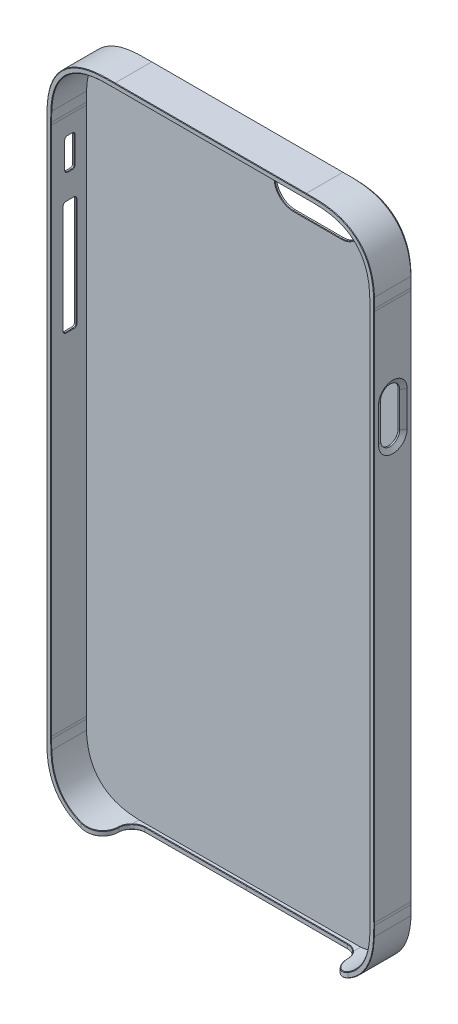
SolidWorks part; units mm, degrees
ref_plane "Alzado" through (0, 0, 0) normal (0, 0, 1) x (1, 0, 0)
ref_plane "Planta" through (0, 0, 0) normal (0, 1, 0) x (1, 0, 0)
ref_plane "Vista lateral" through (0, 0, 0) normal (1, 0, 0) x (0, 0, -1)
sketch "Croquis1" plane through (0, 0, 0) normal (0, 0, 1) x (1, 0, 0)
  line L5 (-140.1494, -3.7576) -> (-142.1279, -3.7576)
  line L16 (-140.1474, 51.4816) -> (-140.1474, 80.9616)
  line L17 (-140.1474, -4.2216) -> (-140.1474, 51.4816)
  line L18 (-140.1474, 51.4816) -> (-140.1474, 80.9616)
  line L19 (-140.1474, -4.2216) -> (-140.1474, 51.4816)
  line L33 (-140.1474, 80.9616) -> (-140.1474, 91.1616)
  line L36 (-209.1174, 107.1847) -> (-209.1174, 103.0696)
  line L37 (-154.5145, 121.5516) -> (-194.7504, 121.5516)
  line L38 (-140.1474, 91.1616) -> (-140.1474, 107.1847)
  line L39 (-209.1174, 107.1847) -> (-209.1174, 103.0696)
  line L40 (-154.5145, 121.5516) -> (-194.7504, 121.5516)
  line L41 (-140.1474, 91.1616) -> (-140.1474, 107.1847)
  line L44 (-150.313, -18.4382) -> (-197.0805, -18.575)
  line L45 (-209.1174, 68.2096) -> (-209.1174, -4.2216)
  line L46 (-209.1174, 68.2096) -> (-209.1174, -4.2216)
  line L47 (-209.1174, 68.2096) -> (-209.1174, 103.0696)
  spline S19 degree 3 poles (-1096.1153, 286.7428) (-158.9407, -76.2316) (-140.157, -30.5078) (-140.1396, -5.1272) (-140.14, -5.0005) (-140.1415, -4.7484) (-140.1426, -4.6248) (-142.7619, 329.0701) (-145.3803, 662.6411) (-147.9989, 996.2116) knots -24.327282 -24.327282 -24.327282 -24.327282 0.5 0.5 0.625 0.625 0.75 0.75 337.321247 337.321247 337.321247 337.321247 only from (-140.1709, -6.8015) to (-140.1494, -3.7576)
  spline S20 degree 3 poles (10596.5565, -21471.9083) (-373.0822, 618.2006) (-222.5435, -37.2569) (-147.5726, -17.8855) (-146.8942, -17.6499) (-145.5876, -17.0402) (-144.9599, -16.6687) (-144.0862, -16.0108) (-143.8063, -15.7747) (-143.2746, -15.2688) (-143.024, -14.9994) (-142.3243, -14.1556) (-141.9247, -13.5435) (-141.2585, -12.2602) (-140.9933, -11.5876) (-118.6996, 63.7143) (-829.1948, 236.0168) (21434.9054, -10505.7862) knots -13.481883 -13.481883 -13.481883 -13.481883 0.125 0.125 0.25 0.25 0.375 0.375 0.4375 0.4375 0.5 0.5 0.625 0.625 0.75 0.75 14.480461 14.480461 14.480461 14.480461 only from (-150.313, -18.4382) to (-140.1709, -6.8015)
  spline S22 degree 3 poles (-150.313, -18.4382) (-149.6264, -18.3576) (-148.9375, -18.2382) (-147.5726, -17.8855) (-146.8942, -17.6499) (-145.5876, -17.0402) (-144.9599, -16.6687) (-144.0862, -16.0108) (-143.8063, -15.7747) (-143.2746, -15.2688) (-143.024, -14.9994) (-142.3243, -14.1556) (-141.9247, -13.5435) (-141.2585, -12.2602) (-140.9933, -11.5876) (-140.3899, -9.5496) (-140.2305, -8.1585) (-140.1709, -6.8015) knots 0 0 0 0 0.125 0.125 0.25 0.25 0.375 0.375 0.4375 0.4375 0.5 0.5 0.625 0.625 0.75 0.75 1 1 1 1
  spline S35 degree 3 poles (-21608.4449, 10693.918) (21117.6762, -11397.0508) (-21185.0362, 11790.8934) (20689.3897, -11913.1281) knots -409.88411 -409.88411 -409.88411 -409.88411 410.03234 410.03234 410.03234 410.03234 only from (-140.1416, -4.7497) to (-140.1474, -4.2216)
  spline S36 degree 3 poles (-22072.2785, 9707.2404) (21604.4405, -10409.9708) (-21694.4237, 10806.1344) (21221.0865, -10932.7045) knots -106.808987 -106.808987 -106.808987 -106.808987 108.936675 108.936675 108.936675 108.936675 only from (-140.1709, -6.8015) to (-140.1416, -4.7497)
  spline S37 degree 3 poles (-140.1416, -4.7497) (-140.143, -4.5724) (-140.145, -4.3963) (-140.1474, -4.2216) knots 0 0 0 0 1 1 1 1
  spline S38 degree 3 poles (-140.1709, -6.8015) (-140.1403, -6.1063) (-140.1363, -5.4195) (-140.1416, -4.7497) knots 0 0 0 0 1 1 1 1
  spline S73 degree 3 poles (21259.18, -10590.9548) (-21466.941, 11500.0139) (20835.7713, -11687.9302) (-21038.6545, 12016.0912) knots -409.88411 -409.88411 -409.88411 -409.88411 410.03234 410.03234 410.03234 410.03234 only from (-209.1233, 107.7129) to (-209.1174, 107.1847)
  spline S74 degree 3 poles (21723.0137, -9604.2772) (-21953.7053, 10512.9339) (21345.1588, -10703.1713) (-21570.3513, 11035.6676) knots -106.808987 -106.808987 -106.808987 -106.808987 108.936675 108.936675 108.936675 108.936675 only from (-209.094, 109.7646) to (-209.1233, 107.7129)
  spline S75 degree 3 poles (-10801.3002, 21643.3549) (-28.9993, -429.2618) (-122.897, 134.4698) (-200.7147, 121.1241) (-201.5799, 120.9011) (-203.2628, 120.2345) (-204.0722, 119.7955) (-205.1812, 118.977) (-205.5332, 118.6774) (-206.191, 118.0247) (-206.4933, 117.675) (-207.3205, 116.572) (-207.766, 115.7654) (-208.4451, 114.0858) (-208.6735, 113.2207) (-222.1816, 36.5608) (338.8212, -58.2507) (-21959.2671, 10241.8024) knots -10.85602 -10.85602 -10.85602 -10.85602 0.25 0.25 0.375 0.375 0.5 0.5 0.5625 0.5625 0.625 0.625 0.75 0.75 0.875 0.875 11.81479 11.81479 11.81479 11.81479 only from (-194.7504, 121.5516) to (-209.094, 109.7646)
  spline S76 degree 3 poles (21609.3626, 10241.5069) (-688.0753, -58.2488) (-127.0834, 36.5616) (-140.5913, 113.2207) (-140.8197, 114.0858) (-141.4989, 115.7654) (-141.9443, 116.572) (-142.7715, 117.675) (-143.0738, 118.0247) (-143.7316, 118.6774) (-144.0837, 118.977) (-145.1926, 119.7955) (-146.0021, 120.2345) (-147.685, 120.9011) (-148.5501, 121.1241) (-226.3684, 134.4699) (-320.2669, -429.2698) (10452.2639, 21643.8233) knots -10.814685 -10.814685 -10.814685 -10.814685 0.125 0.125 0.25 0.25 0.375 0.375 0.4375 0.4375 0.5 0.5 0.625 0.625 0.75 0.75 11.856099 11.856099 11.856099 11.856099 only from (-140.1709, 109.7646) to (-154.5145, 121.5516)
  spline S77 degree 3 poles (21221.4874, 11035.8707) (-21694.7524, -10703.3333) (21604.6957, 10513.055) (-22072.4589, -9604.3603) knots -107.937347 -107.937347 -107.937347 -107.937347 107.809284 107.809284 107.809284 107.809284 only from (-140.1416, 107.7129) to (-140.1709, 109.7646)
  spline S78 degree 3 poles (20689.5764, 12016.1969) (-21185.6906, -11688.2984) (21118.8078, 11500.6323) (-21610.0631, -10591.7915) knots -409.033558 -409.033558 -409.033558 -409.033558 410.894461 410.894461 410.894461 410.894461 only from (-140.1474, 107.1847) to (-140.1416, 107.7129)
  spline S79 degree 3 poles (-209.1233, 107.7129) (-209.1219, 107.5356) (-209.1198, 107.3595) (-209.1174, 107.1847) knots 0 0 0 0 1 1 1 1
  spline S80 degree 3 poles (-209.094, 109.7646) (-209.1245, 109.0694) (-209.1285, 108.3827) (-209.1233, 107.7129) knots 0 0 0 0 1 1 1 1
  spline S81 degree 3 poles (-194.7504, 121.5516) (-196.3756, 121.5744) (-198.1164, 121.5697) (-200.7147, 121.1241) (-201.5799, 120.9011) (-203.2628, 120.2345) (-204.0722, 119.7955) (-205.1812, 118.977) (-205.5332, 118.6774) (-206.191, 118.0247) (-206.4933, 117.675) (-207.3205, 116.572) (-207.766, 115.7654) (-208.4451, 114.0858) (-208.6735, 113.2207) (-208.9788, 111.4886) (-209.0564, 110.6201) (-209.094, 109.7646) knots 0 0 0 0 0.25 0.25 0.375 0.375 0.5 0.5 0.5625 0.5625 0.625 0.625 0.75 0.75 0.875 0.875 1 1 1 1
  spline S82 degree 3 poles (-140.1709, 109.7646) (-140.2085, 110.6201) (-140.2861, 111.4886) (-140.5913, 113.2207) (-140.8197, 114.0858) (-141.4989, 115.7654) (-141.9443, 116.572) (-142.7715, 117.675) (-143.0738, 118.0247) (-143.7316, 118.6774) (-144.0837, 118.977) (-145.1926, 119.7955) (-146.0021, 120.2345) (-147.685, 120.9011) (-148.5501, 121.1241) (-151.1484, 121.5697) (-152.8892, 121.5744) (-154.5145, 121.5516) knots 0 0 0 0 0.125 0.125 0.25 0.25 0.375 0.375 0.4375 0.4375 0.5 0.5 0.625 0.625 0.75 0.75 1 1 1 1
  spline S83 degree 3 poles (-140.1416, 107.7129) (-140.1363, 108.3827) (-140.1403, 109.0694) (-140.1709, 109.7646) knots 0 0 0 0 1 1 1 1
  spline S84 degree 3 poles (-140.1474, 107.1847) (-140.145, 107.3595) (-140.143, 107.5356) (-140.1416, 107.7129) knots 0 0 0 0 1 1 1 1
  spline S88 degree 3 poles (-21682.2426, -10714.3251) (522.8439, 261.5338) (-233.5537, 62.6471) (-207.8126, -12.876) (-206.9668, -14.3155) (-205.2058, -16.0262) (-204.5482, -16.5125) (-203.1494, -17.3194) (-202.4063, -17.6394) (-127.053, -41.4547) (58.2883, 692.5988) (-10805.5064, -21539.7725) knots -12.056417 -12.056417 -12.056417 -12.056417 0.25 0.25 0.5 0.5 0.625 0.625 0.75 0.75 13.107269 13.107269 13.107269 13.107269 only from (-209.094, -6.8015) to (-197.0805, -18.575)
  spline S89 degree 3 poles (-21570.7522, -10932.9075) (21345.4875, 10806.2965) (-21953.9605, -10410.0918) (21723.194, 9707.3234) knots -107.937347 -107.937347 -107.937347 -107.937347 107.809284 107.809284 107.809284 107.809284 only from (-209.1233, -4.7497) to (-209.094, -6.8015)
  spline S90 degree 3 poles (-21038.8412, -11913.2338) (20836.4257, 11791.2615) (-21468.0726, -11397.6691) (21260.7982, 10694.7546) knots -409.033558 -409.033558 -409.033558 -409.033558 410.894461 410.894461 410.894461 410.894461 only from (-209.1174, -4.2216) to (-209.1233, -4.7497)
  spline S91 degree 3 poles (-209.094, -6.8015) (-209.0275, -8.3135) (-208.8376, -9.8687) (-207.8126, -12.876) (-206.9668, -14.3155) (-205.2058, -16.0262) (-204.5482, -16.5125) (-203.1494, -17.3194) (-202.4063, -17.6394) (-200.1425, -18.3549) (-198.5879, -18.5218) (-197.0805, -18.575) knots 0 0 0 0 0.25 0.25 0.5 0.5 0.625 0.625 0.75 0.75 1 1 1 1
  spline S92 degree 3 poles (-209.1233, -4.7497) (-209.1285, -5.4195) (-209.1245, -6.1063) (-209.094, -6.8015) knots 0 0 0 0 1 1 1 1
  spline S93 degree 3 poles (-209.1174, -4.2216) (-209.1198, -4.3963) (-209.1219, -4.5724) (-209.1233, -4.7497) knots 0 0 0 0 1 1 1 1
  dimension "D1" = 1
  dimension "D2" = 1
  dimension "D4" = 1
  dimension "D3" = 1
extrude "Saliente-Extruir1" add sketch "Croquis1" along normal blind 8.4
sketch "Croquis2" plane through (0, 0, 8.4) normal (0, 0, 1) x (1, 0, 0)
  line L16 (-208.1233, 107.7223) -> (-208.1174, 107.1902)
  line L17 (-208.1174, 107.1902) -> (-208.1174, -4.2271)
  line L18 (-208.1174, -4.2271) -> (-208.1233, -4.7592)
  line L19 (-197.0641, -17.575) -> (-150.3738, -17.4384)
  line L20 (-141.1415, -4.7592) -> (-141.1474, -4.2271)
  line L21 (-141.1474, -4.2271) -> (-141.1474, 107.1902)
  line L22 (-141.1474, 107.1902) -> (-141.1415, 107.7223)
  line L23 (-154.5074, 120.5516) -> (-194.7574, 120.5516)
  line L24 (-208.1233, 107.7223) -> (-208.1174, 107.1902)
  line L25 (-208.1174, 107.1902) -> (-208.1174, -4.2271)
  line L26 (-208.1174, -4.2271) -> (-208.1233, -4.7592)
  line L27 (-197.0641, -17.575) -> (-150.3738, -17.4384)
  line L28 (-141.1415, -4.7592) -> (-141.1474, -4.2271)
  line L29 (-141.1474, -4.2271) -> (-141.1474, 107.1902)
  line L30 (-141.1474, 107.1902) -> (-141.1415, 107.7223)
  line L31 (-154.5074, 120.5516) -> (-194.7574, 120.5516)
  spline S16 degree 3 poles (-3205.7699, -81.6252) (2792.241, 224.0248) (-3208.5375, -225.8688) (2789.8108, 59.0522) knots -58.686811 -58.686811 -58.686811 -58.686811 57.439594 57.439594 57.439594 57.439594 only from (-208.1233, -4.7592) to (-208.0949, -6.7576)
  spline S17 degree 3 poles (-3180.5876, -400.9387) (-17.3155, 101.053) (-220.1554, 26.5423) (-207.2636, -11.3879) (-207.1273, -11.7279) (-206.8207, -12.3868) (-206.65, -12.7069) (-206.2719, -13.3272) (-206.0637, -13.6283) (-205.6091, -14.2046) (-205.3662, -14.4753) (-204.848, -14.9806) (-204.5729, -15.2154) (-203.9929, -15.6517) (-203.6861, -15.8543) (-202.7366, -16.4051) (-202.0703, -16.695) (-201.0267, -17.0276) (-200.6711, -17.1217) (-199.9588, -17.2786) (-199.6006, -17.342) (-160.4017, -22.9081) (-102.0994, 113.587) (-489.4912, -3001.828) knots -6.520508 -6.520508 -6.520508 -6.520508 0.25 0.25 0.3125 0.3125 0.375 0.375 0.4375 0.4375 0.5 0.5 0.5625 0.5625 0.625 0.625 0.75 0.75 0.8125 0.8125 0.875 0.875 7.619701 7.619701 7.619701 7.619701 only from (-208.0949, -6.7576) to (-197.0641, -17.575)
  spline S18 degree 3 poles (566.2726, -2928.9047) (-296.2111, 206.6142) (-184.1381, -34.0737) (-146.3392, -16.2862) (-146.0476, -16.1309) (-145.4884, -15.7947) (-145.2189, -15.613) (-144.7011, -15.2209) (-144.4528, -15.0105) (-143.9797, -14.5582) (-143.7547, -14.3153) (-143.1312, -13.5595) (-142.7763, -13.0149) (-142.3249, -12.1434) (-142.1882, -11.8426) (-141.9467, -11.236) (-141.8409, -10.9287) (-141.5653, -9.9957) (-141.4348, -9.3595) (-136.0038, 28.9017) (-263.4162, 93.3591) (2512.374, -1405.3837) knots -7.675067 -7.675067 -7.675067 -7.675067 0.25 0.25 0.3125 0.3125 0.375 0.375 0.4375 0.4375 0.5 0.5 0.625 0.625 0.6875 0.6875 0.75 0.75 0.875 0.875 8.147229 8.147229 8.147229 8.147229 only from (-150.3738, -17.4384) to (-141.1699, -6.7576)
  spline S19 degree 3 poles (-3110.1532, 411.9114) (-210.414, -80.6863) (-142.1205, -44.1164) (-141.1515, -6.2228) (-141.1469, -6.0445) (-141.1439, -5.8661) (-141.142, -5.6878) (-140.7319, 33.4379) (-198.1405, 73.2568) (2857.1742, -46.2878) knots -0.113183 -0.113183 -0.113183 -0.113183 0.000535 0.000535 0.000535 0.00107 0.00107 0.00107 0.118455 0.118455 0.118455 0.118455 only from (-141.1699, -6.7576) to (-141.1415, -4.7592)
  spline S20 degree 3 poles (2856.505, 184.5884) (-3141.5058, -121.0617) (2859.2727, 328.8319) (-3139.0757, 43.911) knots -58.686811 -58.686811 -58.686811 -58.686811 57.439594 57.439594 57.439594 57.439594 only from (-141.1415, 107.7223) to (-141.1699, 109.7207)
  spline S21 degree 3 poles (2834.4385, 479.5604) (-287.3195, 7.6304) (-134.5347, 73.0031) (-141.4937, 112.5803) (-141.582, 112.9819) (-141.8016, 113.7781) (-141.9339, 114.1743) (-142.3986, 115.3215) (-142.7969, 116.0422) (-143.7955, 117.3735) (-144.3777, 117.9501) (-145.3717, 118.6853) (-145.7246, 118.9101) (-146.4481, 119.3081) (-146.8208, 119.4828) (-147.5866, 119.7869) (-147.9817, 119.9163) (-148.7817, 120.1321) (-149.1842, 120.2183) (-189.2346, 127.0772) (-248.8682, -26.4563) (190.832, 3099.281) knots -5.928664 -5.928664 -5.928664 -5.928664 0.125 0.125 0.1875 0.1875 0.25 0.25 0.375 0.375 0.5 0.5 0.5625 0.5625 0.625 0.625 0.6875 0.6875 0.75 0.75 6.875598 6.875598 6.875598 6.875598 only from (-141.1699, 109.7207) to (-154.5074, 120.5516)
  spline S22 degree 3 poles (-281.5963, 3117.8275) (-109.4713, -26.9653) (-160.0066, 127.1006) (-200.0903, 120.2164) (-200.4975, 120.1287) (-201.2938, 119.9129) (-201.6844, 119.7847) (-202.4479, 119.4811) (-202.821, 119.306) (-203.5485, 118.9053) (-203.8979, 118.6819) (-204.5569, 118.1942) (-204.8681, 117.9288) (-205.4502, 117.3509) (-205.7227, 117.0362) (-206.4699, 116.0388) (-206.8685, 115.318) (-207.335, 114.1633) (-207.4662, 113.7686) (-207.6843, 112.9756) (-207.7721, 112.5754) (-214.7383, 72.8952) (-61.5564, 4.7572) (-3177.4936, 526.0269) knots -5.839204 -5.839204 -5.839204 -5.839204 0.25 0.25 0.3125 0.3125 0.375 0.375 0.4375 0.4375 0.5 0.5 0.5625 0.5625 0.625 0.625 0.75 0.75 0.8125 0.8125 0.875 0.875 6.96099 6.96099 6.96099 6.96099 only from (-194.7574, 120.5516) to (-208.0949, 109.7207)
  spline S23 degree 3 poles (2760.8883, -308.9482) (-138.8508, 183.6494) (-207.1443, 147.0795) (-208.1134, 109.1859) (-208.1179, 109.0076) (-208.121, 108.8293) (-208.1229, 108.6509) (-208.533, 69.5252) (-151.1243, 29.7063) (-3206.439, 149.2509) knots -0.113183 -0.113183 -0.113183 -0.113183 0.000535 0.000535 0.000535 0.00107 0.00107 0.00107 0.118455 0.118455 0.118455 0.118455 only from (-208.0949, 109.7207) to (-208.1233, 107.7223)
  spline S24 degree 3 poles (-208.1233, -4.7592) (-208.1285, -5.4254) (-208.1242, -6.0919) (-208.0949, -6.7576) knots 0 0 0 0 1 1 1 1
  spline S25 degree 3 poles (-208.0949, -6.7576) (-208.0309, -8.2151) (-207.8532, -9.6532) (-207.2636, -11.3879) (-207.1273, -11.7279) (-206.8207, -12.3868) (-206.65, -12.7069) (-206.2719, -13.3272) (-206.0637, -13.6283) (-205.6091, -14.2046) (-205.3662, -14.4753) (-204.848, -14.9806) (-204.5729, -15.2154) (-203.9929, -15.6517) (-203.6861, -15.8543) (-202.7366, -16.4051) (-202.0703, -16.695) (-201.0267, -17.0276) (-200.6711, -17.1217) (-199.9588, -17.2786) (-199.6006, -17.342) (-198.5208, -17.4953) (-197.7944, -17.5487) (-197.0641, -17.575) knots 0 0 0 0 0.25 0.25 0.3125 0.3125 0.375 0.375 0.4375 0.4375 0.5 0.5 0.5625 0.5625 0.625 0.625 0.75 0.75 0.8125 0.8125 0.875 0.875 1 1 1 1
  spline S26 degree 3 poles (-150.3738, -17.4384) (-149.0753, -17.2817) (-147.818, -16.9821) (-146.3392, -16.2862) (-146.0476, -16.1309) (-145.4884, -15.7947) (-145.2189, -15.613) (-144.7011, -15.2209) (-144.4528, -15.0105) (-143.9797, -14.5582) (-143.7547, -14.3153) (-143.1312, -13.5595) (-142.7763, -13.0149) (-142.3249, -12.1434) (-142.1882, -11.8426) (-141.9467, -11.236) (-141.8409, -10.9287) (-141.5653, -9.9957) (-141.4348, -9.3595) (-141.2512, -8.0664) (-141.1987, -7.4119) (-141.1699, -6.7576) knots 0 0 0 0 0.25 0.25 0.3125 0.3125 0.375 0.375 0.4375 0.4375 0.5 0.5 0.625 0.625 0.6875 0.6875 0.75 0.75 0.875 0.875 1 1 1 1
  spline S27 degree 3 poles (-141.1699, -6.7576) (-141.1621, -6.5794) (-141.156, -6.4011) (-141.1515, -6.2228) (-141.1469, -6.0445) (-141.1439, -5.8661) (-141.142, -5.6878) (-141.1387, -5.3783) (-141.1391, -5.0687) (-141.1415, -4.7592) knots 0 0 0 0 0.000535 0.000535 0.000535 0.00107 0.00107 0.00107 0.001999 0.001999 0.001999 0.001999
  spline S28 degree 3 poles (-141.1415, 107.7223) (-141.1363, 108.3886) (-141.1407, 109.055) (-141.1699, 109.7207) knots 0 0 0 0 1 1 1 1
  spline S29 degree 3 poles (-141.1699, 109.7207) (-141.2062, 110.547) (-141.2804, 111.367) (-141.4937, 112.5803) (-141.582, 112.9819) (-141.8016, 113.7781) (-141.9339, 114.1743) (-142.3986, 115.3215) (-142.7969, 116.0422) (-143.7955, 117.3735) (-144.3777, 117.9501) (-145.3717, 118.6853) (-145.7246, 118.9101) (-146.4481, 119.3081) (-146.8208, 119.4828) (-147.5866, 119.7869) (-147.9817, 119.9163) (-148.7817, 120.1321) (-149.1842, 120.2183) (-151.2068, 120.5647) (-152.8581, 120.5747) (-154.5074, 120.5516) knots 0 0 0 0 0.125 0.125 0.1875 0.1875 0.25 0.25 0.375 0.375 0.5 0.5 0.5625 0.5625 0.625 0.625 0.6875 0.6875 0.75 0.75 1 1 1 1
  spline S30 degree 3 poles (-194.7574, 120.5516) (-196.4068, 120.5747) (-198.0541, 120.5662) (-200.0903, 120.2164) (-200.4975, 120.1287) (-201.2938, 119.9129) (-201.6844, 119.7847) (-202.4479, 119.4811) (-202.821, 119.306) (-203.5485, 118.9053) (-203.8979, 118.6819) (-204.5569, 118.1942) (-204.8681, 117.9288) (-205.4502, 117.3509) (-205.7227, 117.0362) (-206.4699, 116.0388) (-206.8685, 115.318) (-207.335, 114.1633) (-207.4662, 113.7686) (-207.6843, 112.9756) (-207.7721, 112.5754) (-207.9845, 111.3653) (-208.0586, 110.5464) (-208.0949, 109.7207) knots 0 0 0 0 0.25 0.25 0.3125 0.3125 0.375 0.375 0.4375 0.4375 0.5 0.5 0.5625 0.5625 0.625 0.625 0.75 0.75 0.8125 0.8125 0.875 0.875 1 1 1 1
  spline S31 degree 3 poles (-208.0949, 109.7207) (-208.1027, 109.5425) (-208.1088, 109.3642) (-208.1134, 109.1859) (-208.1179, 109.0076) (-208.121, 108.8293) (-208.1229, 108.6509) (-208.1261, 108.3414) (-208.1257, 108.0318) (-208.1233, 107.7223) knots 0 0 0 0 0.000535 0.000535 0.000535 0.00107 0.00107 0.00107 0.001999 0.001999 0.001999 0.001999
  dimension "D1" = 1
extrude "Cortar-Extruir1" cut sketch "Croquis2" against normal blind 7.4
sketch "Croquis3" plane through (-209.1174, 0, 0) normal (-1, 0, 0) x (0, 0, 1)
  line L0 (4.95, 97.9096) -> (4.95, 102.6196) construction
  line L1 (5.45, 103.5196) -> (3.45, 103.5196)
  line L2 (5.45, 103.5196) -> (5.45, 97.0096)
  line L3 (5.45, 97.0096) -> (3.45, 97.0096)
  line L4 (3.45, 103.5196) -> (3.45, 97.0096)
  line L5 (3.95, 102.6196) -> (3.95, 97.9096) construction
  line L6 (4.55, 103.0196) -> (4.35, 103.0196) construction
  line L7 (4.4487, 91.1696) -> (4.45, 91.6696) construction
  line L8 (5.7926, 91.6696) -> (3.1074, 91.6696)
  line L9 (5.7926, 91.6696) -> (5.7926, 67.8596)
  line L10 (4.45, 97.0096) -> (4.45, 97.5096) construction
  line L11 (5.7926, 67.8596) -> (3.1074, 67.8596)
  line L12 (3.1074, 91.6696) -> (3.1074, 67.8596)
  line L13 (4.45, 67.8596) -> (4.4487, 68.3596) construction
  line L14 (4.45, 103.0196) -> (4.45, 103.5196) construction
  line L15 (4.35, 97.5096) -> (4.55, 97.5096) construction
  line L16 (4.45, 91.6696) -> (4.45, 97.0096) construction
  arc A0 (5.29, 90.3283) -> (3.6074, 90.3283) centre (4.4487, 90.3283) ccw construction
  arc A1 (3.6074, 69.2008) -> (5.29, 69.2008) centre (4.4487, 69.2008) ccw construction
  dimension "D1" = 0.5
  dimension "D2" = 0.5
  dimension "D3" = 0.5
  dimension "D4" = 0.5
  dimension "D5" = 0.5
  dimension "D6" = 0.5
  dimension "D7" = 2.6852
extrude "Cortar-Extruir2" cut sketch "Croquis3" against normal up to next
sketch "Croquis4" plane through (0, 0, 0) normal (0, 0, -1) x (-1, 0, 0)
  line L0 (154.4574, 113.6716) -> (164.5074, 113.6716) construction
  line L1 (154.4574, 117.6716) -> (164.5074, 117.6716)
  line L2 (154.4574, 109.6716) -> (164.5074, 109.6716)
  arc A0 (154.4574, 117.6716) -> (154.4574, 109.6716) centre (154.4574, 113.6716) ccw
  arc A1 (164.5074, 109.6716) -> (164.5074, 117.6716) centre (164.5074, 113.6716) ccw
  point P3 (159.4824, 113.6716)
  dimension "D1" = 4
extrude "Cortar-Extruir3" cut sketch "Croquis4" against normal up to next
fillet "Redondeo1" radius 0.5 8 edges at (-208.6174, 97.0096, 3.45) (-208.6174, 97.0096, 5.45) (-208.6174, 103.5196, 5.45) (-208.6174, 103.5196, 3.45) (-208.6174, 67.8596, 5.7926) (-208.6174, 67.8596, 3.1074) (-208.6174, 91.6696, 5.7926) (-208.6174, 91.6696, 3.1074)
sketch "Croquis5" plane through (0.0497, -16.9984, 0) normal (-0.0029, 1, 0) x (1, 0.0029, 0)
  line L0 (-173.7694, -8.4) -> (-173.7502, 0) construction
  line L1 (-197.1147, -8.4) -> (-150.4242, -8.4) construction
  line L2 (-197.134, 0) -> (-150.3663, 0) construction
  line L3 (-195.0926, -4.45) -> (-173.7604, -4.45) construction
  line L5 (-152.4158, -1.7979) -> (-173.7541, -1.7)
  line L6 (-195.0926, -4.45) -> (-173.7604, -4.45) construction
  line L7 (-195.0926, -1.7) -> (-173.7541, -1.7)
  line L9 (-209.113, -8.4) -> (-197.134, -8.4) construction
  line L10 (-208.772, -8.4) -> (-194.394, -8.4) construction
  line L15 (-201.8424, -8.4) -> (-145.68, -8.4)
  arc A0 (-195.0926, -1.7) -> (-197.8425, -4.4296) centre (-195.0926, -4.45) ccw
  arc A1 (-201.8424, -8.4) -> (-197.8425, -4.4296) centre (-201.8424, -4.4) ccw
  arc A2 (-152.4158, -1.7979) -> (-149.679, -4.4876) centre (-152.4284, -4.5479) cw
  arc A3 (-149.679, -4.4876) -> (-145.68, -8.4) centre (-145.68, -4.4) ccw
  ellipse E0 centre (-195.0926, -4.45) end of major axis (-195.0926, -6.45) minor radius 2 construction
  dimension "D1" = 2.75
  dimension "D2" = 8
  dimension "D3" = 8
extrude "Cortar-Extruir4" cut sketch "Croquis5" against normal up to next
sketch "Croquis7" plane through (0.0497, -16.9984, 0) normal (0.0029, -1, 0) x (1, 0.0029, 0)
  line L2 (-197.1147, 2.5863) -> (-197.1147, 8.4)
  line L3 (-197.1147, 8.4) -> (-201.8424, 8.4)
  line L4 (-197.1147, 2.5863) -> (-197.1147, 8.4)
  line L5 (-197.1147, 8.4) -> (-201.8424, 8.4)
  line L10 (-150.4242, 8.4) -> (-150.4242, 2.6649)
  line L11 (-146.4708, 8.3211) -> (-146.4707, 8.4)
  line L12 (-146.4707, 8.4) -> (-150.4242, 8.4)
  arc A2 (-197.8425, 4.4296) -> (-201.8424, 8.4) centre (-201.8424, 4.4) ccw
  arc A3 (-197.8425, 4.4296) -> (-197.1147, 2.5863) centre (-195.0926, 4.45) ccw
  arc A4 (-197.8425, 4.4296) -> (-201.8424, 8.4) centre (-201.8424, 4.4) ccw
  arc A5 (-197.8425, 4.4296) -> (-197.1147, 2.5863) centre (-195.0926, 4.45) ccw
  arc A8 (-150.4242, 2.6649) -> (-149.679, 4.4876) centre (-152.4284, 4.5479) ccw
  arc A9 (-146.4708, 8.3211) -> (-149.679, 4.4876) centre (-145.68, 4.4) ccw
  dimension "D1" = 0
extrude "Cortar-Extruir7" cut sketch "Croquis7" against normal blind 2
sketch "Croquis8" plane through (0.0526, -17.9984, 0) normal (0.0029, -1, 0) x (1, 0.0029, 0)
  line L0 (-146.4707, 8.4) -> (-146.4708, 8.3211) construction
  line L1 (-140.1902, 8.4) -> (-146.4707, 8.4) construction
  line L2 (-146.4707, 8.4) -> (-146.4708, 8.3211)
  line L3 (-140.1902, 8.4) -> (-146.4707, 8.4)
  arc A1 (-145.68, 8.4) -> (-146.4708, 8.3211) centre (-145.68, 4.4) ccw
  arc A2 (-146.4708, 8.3211) -> (-149.679, 4.4876) centre (-145.68, 4.4) ccw construction
extrude "Cortar-Extruir8" cut sketch "Croquis8" against normal blind 3 contours A1 L3 L2
sketch "Croquis9" plane through (-140.1474, 0, 0) normal (1, 0, 0) x (0, 0, -1)
  line L0 (-4.45, 89.7616) -> (-4.45, 82.3616) construction
  line L1 (-2.45, 89.7616) -> (-2.45, 82.3616)
  line L2 (-6.45, 89.7616) -> (-6.45, 82.3616)
  arc A0 (-2.45, 89.7616) -> (-6.45, 89.7616) centre (-4.45, 89.7616) ccw
  arc A1 (-6.45, 82.3616) -> (-2.45, 82.3616) centre (-4.45, 82.3616) ccw
  point P4 (-4.45, 86.0616)
  dimension "D1" = 2
extrude "Cortar-Extruir9" cut sketch "Croquis9" against normal up to next
chamfer "Chaflán2" distance 1 angle 30 24 edges at (-209.1174, 100.2646, 3.45) (-209.1174, 97.156, 3.5964) (-209.1174, 103.3731, 3.5964) (-209.1174, 97.156, 5.3036) (-209.1174, 103.3731, 5.3036) (-209.1174, 100.2646, 5.45) (-209.1174, 97.0096, 4.45) (-209.1174, 103.5196, 4.45) (-209.1174, 79.7646, 5.7926) (-209.1174, 91.5231, 5.6462) (-209.1174, 68.006, 5.6462) (-209.1174, 91.6696, 4.45) (-209.1174, 67.8596, 4.45) (-209.1174, 91.5231, 3.2538) (-209.1174, 68.006, 3.2538) (-209.1174, 79.7646, 3.1074) (-159.4824, 117.6716, 0) (-150.4574, 113.6716, 0) (-168.5074, 113.6716, 0) (-159.4824, 109.6716, 0) (-140.1474, 86.0616, 6.45) (-140.1474, 80.3616, 4.45) (-140.1474, 91.7616, 4.45) (-140.1474, 86.0616, 2.45)
chamfer "Chaflán3" distance 0.6 angle 45 9 edges
chamfer "Chaflán5" distance 0.1 angle 45 19 edges at (-141.1474, 51.4816, 8.4) (-147.7677, -16.8764, 7.7817) (-149.8645, -17.369, 3.4326) (-163.0345, -17.4754, 1.749) (-151.2804, -17.441, 2.0265) (-196.1459, -17.5723, 1.9313) (-184.3728, -17.5378, 1.7) (-208.1174, 51.4816, 8.4) (-197.6306, -17.5487, 3.5214) (-199.3556, -17.3763, 7.572)
chamfer "Chaflán6" distance 0.1 angle 45 46 edges at (-197.6276, -18.5505, 3.5214) (-199.3361, -18.3895, 7.5593) (-149.8282, -18.3746, 3.5111) (-147.7517, -17.9206, 7.7898) (-184.3699, -18.5378, 1.7) (-163.0316, -18.4754, 1.749) (-159.4824, 109.6716, 1) (-150.4574, 113.6716, 1) (-168.5074, 113.6716, 1) (-159.4824, 117.6716, 1) (-208.1174, 100.2646, 5.45) (-208.1174, 97.156, 5.3036) (-208.1174, 103.3731, 5.3036) (-208.1174, 97.0096, 4.45) (-208.1174, 103.5196, 4.45) (-208.1174, 97.156, 3.5964) (-208.1174, 103.3731, 3.5964) (-208.1174, 100.2646, 3.45) (-208.1174, 67.8596, 4.45) (-208.1174, 68.006, 3.2538) (-208.1174, 68.006, 5.6462) (-208.1174, 79.7646, 3.1074) (-208.1174, 79.7646, 5.7926) (-208.1174, 91.5231, 3.2538) (-208.1174, 91.5231, 5.6462) (-208.1174, 91.6696, 4.45) (-141.1474, 86.0616, 6.45) (-141.1474, 91.7616, 4.45) (-141.1474, 80.3616, 4.45) (-141.1474, 86.0616, 2.45)
sketch "Croquis11" plane through (0, 0, 0) normal (0, 0, -1) x (-1, 0, 0)
  line L0 (140.7474, 91.5516) -> (208.5175, 91.5516) construction
  line L1 (208.5174, -4.2257) -> (208.5176, 107.1888) construction
  line L2 (140.7474, 107.1888) -> (140.7474, -4.2257) construction
  line L3 (154.5145, 121.5516) -> (194.7504, 121.5516) construction
  text T0 "  UNIVERSITAT       POLITÈCNICA  DE VALÈNCIA    Al 5754    " font "Century Gothic" height in points 27
  dimension "D1" = 30
extrude "Saliente-Extruir3" add sketch "Croquis11" along normal blind 0.8
